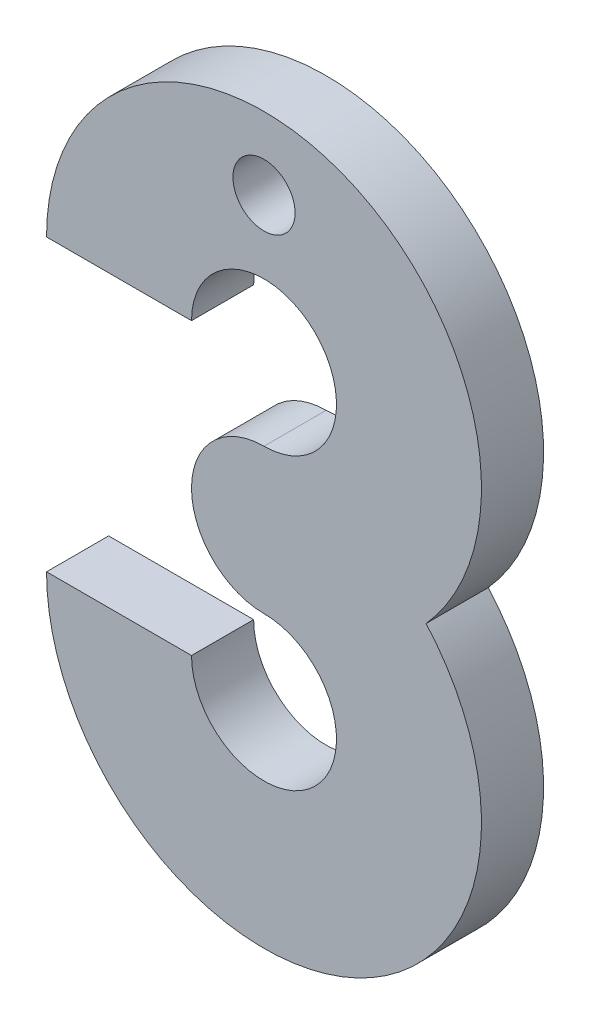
SolidWorks part; units mm, degrees
ref_plane "Front Plane" through (0, 0, 0) normal (0, 0, 1) x (1, 0, 0)
ref_plane "Top Plane" through (0, 0, 0) normal (0, 1, 0) x (1, 0, 0)
ref_plane "Right Plane" through (0, 0, 0) normal (1, 0, 0) x (0, 0, -1)
sketch "Sketch1" plane through (0, 0, 0) normal (0, 0, 1) x (1, 0, 0)
  line L0 (0, 0) -> (42, 0) construction
  line L1 (0, 0) -> (0, 70) construction
  line L2 (0, 14) -> (42, 14) construction
  line L3 (0, 28) -> (14, 28) construction
  line L4 (0, 42) -> (14, 42) construction
  line L5 (0, 56) -> (42, 56) construction
  line L6 (0, 70) -> (42, 70) construction
  line L7 (14, 0) -> (14, 28) construction
  line L8 (28, 0) -> (28, 70) construction
  line L9 (42, 0) -> (42, 70) construction
  line L10 (21, 70) -> (21, 42) construction
  line L11 (21, 28) -> (21, 0) construction
  line L13 (21, 28) -> (42, 28) construction
  line L14 (14, 21) -> (0, 21)
  line L15 (14, 49) -> (0, 49)
  line L17 (36.6525, 35) -> (0, 35) construction
  line L18 (21, 42) -> (42, 42) construction
  line L19 (14, 42) -> (14, 70) construction
  arc A0 (36.6525, 35) -> (0, 49) centre (21, 49) ccw
  circle A1 centre (21, 63) radius 3
  arc A2 (21, 42) -> (14, 49) centre (21, 49) ccw
  arc A3 (14, 21) -> (21, 28) centre (21, 21) ccw
  arc A4 (21, 42) -> (21, 28) centre (21, 35) ccw
  arc A5 (0, 21) -> (36.6525, 35) centre (21, 21) ccw
  dimension "D1" = 6
  dimension "D2" = 42
  dimension "D3" = 14
extrude "Extrude1" add sketch "Sketch1" along normal blind 6
